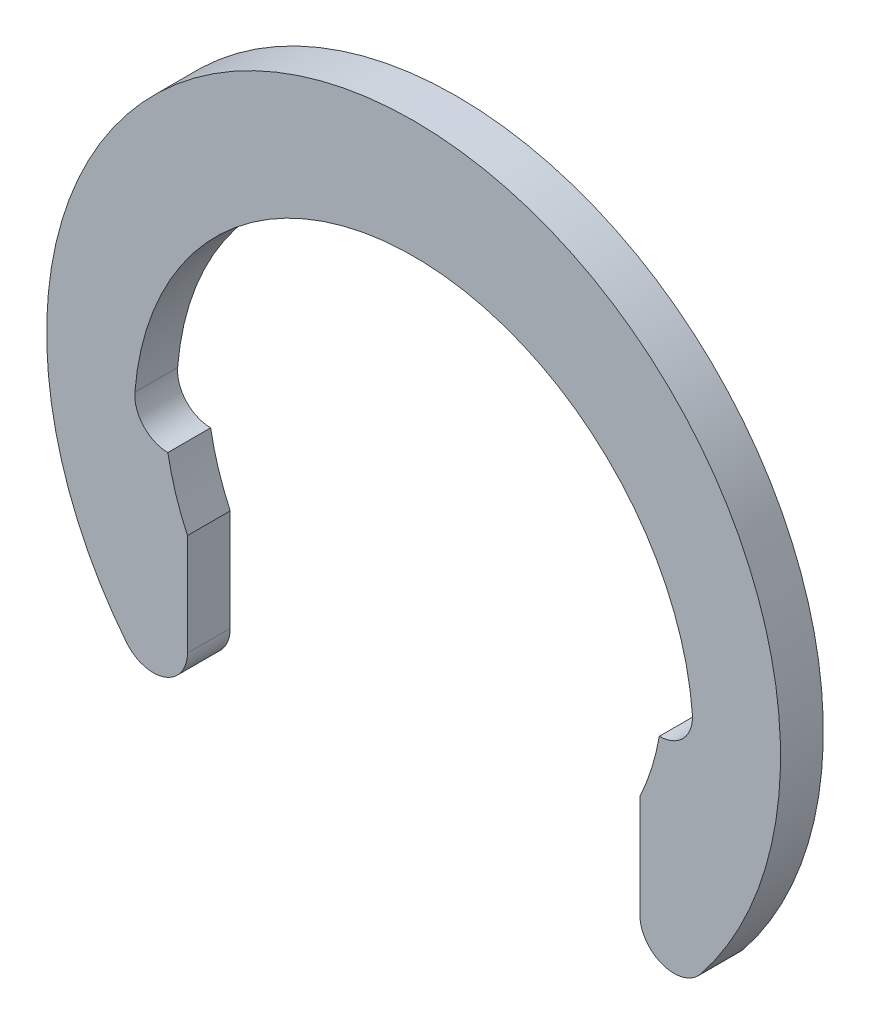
SolidWorks part; units mm, degrees
ref_plane "Plane1" through (0, 0, 0) normal (0, 0, 1) x (1, 0, 0)
ref_plane "Plane2" through (0, 0, 0) normal (0, 1, 0) x (1, 0, 0)
ref_plane "Plane3" through (0, 0, 0) normal (1, 0, 0) x (0, 0, -1)
extrude "Body" add sketch "BodySke" against normal blind 0.6
sketch "BodySke" plane through (0, 0, 0) normal (0, 0, 1) x (1, 0, 0)
  line L0 (-3.9, 0) -> (3.9, 0) construction
  line L1 (0, 0) -> (0, 3.5) construction
  line L2 (0, 0) -> (3.4468, -0.6078) construction
  line L3 (0, 0) -> (3.1721, -1.4792) construction
  line L4 (0, 0) -> (-3.4468, -0.6078) construction
  line L5 (0, 0) -> (-3.1721, -1.4792) construction
  line L6 (3.1721, -1.4792) -> (3.1721, -2.9058)
  line L7 (-3.1721, -1.4792) -> (-3.1721, -2.9058)
  circle A0 centre (0, 0) radius 3.5 construction
  arc A1 (3.9, 0) -> (-3.9, 0) centre (0, -0.4229) ccw construction
  arc A2 (4.0277, -3.2047) -> (-4.0277, -3.2047) centre (0, 0) ccw
  arc A3 (3.1721, -1.4792) -> (3.4468, -0.6078) centre (0, 0) ccw
  arc A4 (3.91, -0.1055) -> (-3.91, -0.1055) centre (0, -0.4229) ccw
  arc A5 (-3.4468, -0.6078) -> (-3.1721, -1.4792) centre (0, 0) ccw
  arc A6 (3.4468, -0.6078) -> (3.91, -0.1055) centre (3.4468, -0.1431) ccw
  arc A7 (-3.91, -0.1055) -> (-3.4468, -0.6078) centre (-3.4468, -0.1431) ccw
  arc A8 (3.1721, -2.9058) -> (4.0277, -3.2047) centre (3.6521, -2.9058) ccw
  arc A9 (-4.0277, -3.2047) -> (-3.1721, -2.9058) centre (-3.6521, -2.9058) ccw
  dimension "D1" = 10
  dimension "GrooveDia" = 7
  dimension "OutsideDia" = 10.2941
  dimension "TipRad" = 0.48
  dimension "CavityWidth" = 7.8
  dimension "D2" = 15
sketch "Clipboard" plane through (0, 0, 0) normal (0, 0, 1) x (1, 0, 0)
  line L0 (0, 0) -> (1.6, 0)
  circle A0 centre (0, 0) radius 3.4
  circle A1 centre (0, 0) radius 5
  dimension "FreeID" = 6.8
  dimension "FreeOD" = 10
  dimension "LargeSection" = 1.6
equation "' \"FreeID@Clipboard\" = 2.18"
equation "' \"Thickness@Body\" = 0.4"
equation "' \"GrooveDia@BodySke\" = 2.3"
equation "' \"FreeOD@Clipboard\" = 3.98"
equation "' \"LargeSection@Clipboard\" = 0.9"
equation "\"OutsideDia@BodySke\" = ( \"GrooveDia@BodySke\"  /  \"FreeID@Clipboard\" )  * \"FreeOD@Clipboard\""
equation "\"CavityWidth@BodySke\" = \"GrooveDia@BodySke\" + 0.25 * 2 * \"LargeSection@Clipboard\""
equation "\"TipRad@BodySke\" = 0.3 * \"LargeSection@Clipboard\""
